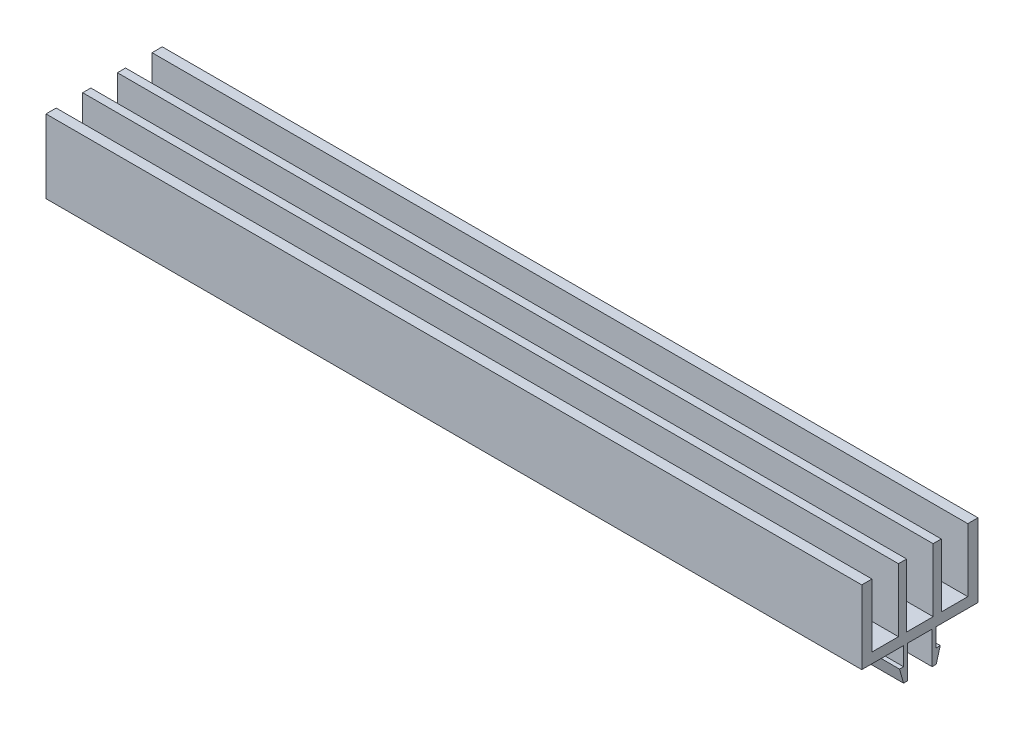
SolidWorks part; units mm, degrees
ref_plane "Front Plane" through (0, 0, 0) normal (0, 0, 1) x (1, 0, 0)
ref_plane "Top Plane" through (0, 0, 0) normal (0, 1, 0) x (1, 0, 0)
ref_plane "Right Plane" through (0, 0, 0) normal (1, 0, 0) x (0, 0, -1)
sketch3d "3DSketch1"
  line L0 (0, 0, 0) -> (200, 0, 0)
other "Paneeliliu'ut 1.6025 PANEELILIUKU 3(1)"
ref_plane "Plane1" through (0, 0, 0) normal (1, 0, 0) x (0, 0, -1)
sketch "Sketch1" plane through (0, 0, 0) normal (1, 0, 0) x (0, 0, -1)
  line L0 (4.1311, -4.9344) -> (14.3811, -4.9344)
  line L1 (14.3811, -4.9344) -> (14.3811, 13.0656)
  line L2 (14.3811, 13.0656) -> (11.8811, 13.0656)
  line L3 (11.8811, 13.0656) -> (11.8811, -2.4344)
  line L4 (11.8811, -2.4344) -> (5.3811, -2.4344)
  line L5 (5.3811, -2.4344) -> (5.3811, 13.0656)
  line L6 (5.3811, 13.0656) -> (3.3811, 13.0656)
  line L7 (3.3811, 13.0656) -> (3.3811, -2.4344)
  line L8 (3.3811, -2.4344) -> (-3.1189, -2.4344)
  line L9 (-3.1189, -2.4344) -> (-3.1189, 13.0656)
  line L10 (-3.1189, 13.0656) -> (-5.1189, 13.0656)
  line L11 (-5.1189, 13.0656) -> (-5.1189, -2.4344)
  line L12 (-5.1189, -2.4344) -> (-11.6189, -2.4344)
  line L13 (-11.6189, -2.4344) -> (-11.6189, 13.0656)
  line L14 (-11.6189, 13.0656) -> (-14.1189, 13.0656)
  line L15 (-14.1189, 13.0656) -> (-14.1189, -4.9344)
  line L16 (-14.1189, -4.9344) -> (-3.8689, -4.9344)
  line L17 (-3.8689, -4.9344) -> (-3.8689, -9.4344)
  line L18 (-3.8689, -9.4344) -> (-4.8689, -9.4344)
  line L19 (-4.8689, -9.4344) -> (-3.8689, -12.9344)
  line L20 (-3.8689, -12.9344) -> (-2.8689, -12.9344)
  line L21 (-2.8689, -12.9344) -> (-2.8689, -4.9344)
  line L22 (-2.8689, -4.9344) -> (3.1311, -4.9344)
  line L23 (3.1311, -4.9344) -> (3.1311, -12.9344)
  line L24 (3.1311, -12.9344) -> (4.1311, -12.9344)
  line L25 (4.1311, -12.9344) -> (5.1311, -9.4344)
  line L26 (5.1311, -9.4344) -> (4.1311, -9.4344)
  line L27 (4.1311, -9.4344) -> (4.1311, -4.9344)
  point P28 (0, 0)
